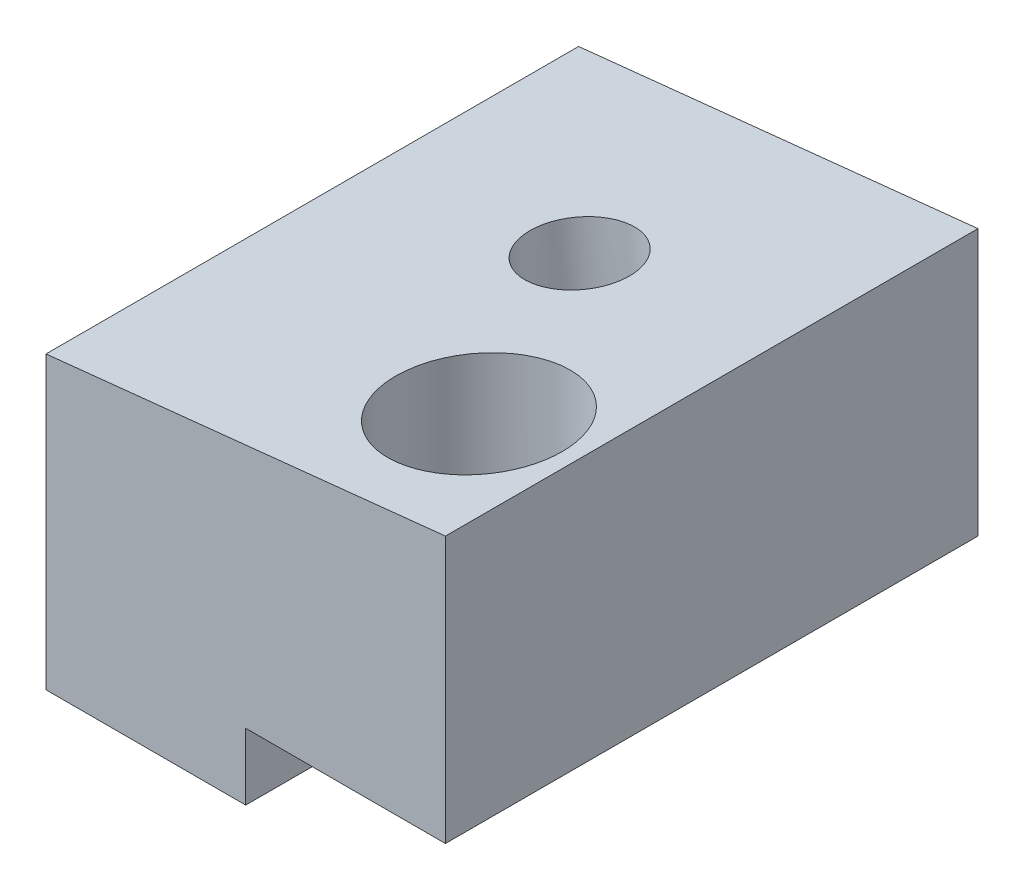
SolidWorks part; units mm, degrees
ref_plane "Front Plane" through (0, 0, 0) normal (0, 0, 1) x (1, 0, 0)
ref_plane "Top Plane" through (0, 0, 0) normal (0, 1, 0) x (1, 0, 0)
ref_plane "Right Plane" through (0, 0, 0) normal (1, 0, 0) x (0, 0, -1)
sketch "Sketch1" plane through (0, 0, 0) normal (0, 0, 1) x (1, 0, 0)
  line L0 (0, 0) -> (9.525, 0)
  line L1 (9.525, 0) -> (9.525, 12.7)
  line L2 (9.525, 12.7) -> (-9.525, 10.6978)
  line L3 (-9.525, 10.6978) -> (-9.525, -3.175)
  line L4 (-9.525, -3.175) -> (0, -3.175)
  line L5 (0, -3.175) -> (0, 0)
  dimension "D1" = 9.525
  dimension "D2" = 9.525
  dimension "D3" = 12.7
  dimension "D4" = 6
  dimension "D5" = 3.175
  dimension "D6" = 19.05
  dimension "D7" = 15.875
extrude "Boss-Extrude1" add sketch "Sketch1" along normal blind 25.4
sketch "Sketch3" plane through (-1.2162, 11.5711, 0) normal (-0.1045, 0.9945, 0) x (0.9945, 0.1045, 0)
  line L0 (10.8003, -25.4) -> (10.8003, 0) construction
  circle A0 centre (1.2753, -9.525) radius 2.3876
  dimension "D1" = 4.7752
  dimension "D2" = 9.525
  dimension "D3" = 9.525
extrude "Cut-Extrude1" cut sketch "Sketch3" against normal blind 15.24
sketch "Sketch4" plane through (0, 0, 0) normal (0, 1, 0) x (1, 0, 0)
  line L0 (9.525, -25.4) -> (9.525, 0) construction
  circle A0 centre (4.7752, -19.05) radius 2.3876
  circle A1 centre (4.7752, -19.05) radius 3.9624
  dimension "D3" = 4.7752
  dimension "D4" = 7.9248
  dimension "D1" = 4.7498
  dimension "D2" = 19.05
sketch "Sketch5" plane through (0, 0, 0) normal (0, 1, 0) x (1, 0, 0)
  circle A0 centre (4.7752, -19.05) radius 2.3876 construction
  circle A1 centre (4.7752, -19.05) radius 2.3876
extrude "Cut-Extrude2" cut sketch "Sketch5" along normal blind 20.32
sketch "Sketch6" plane through (0, 0, 0) normal (0, 1, 0) x (1, 0, 0)
  circle A0 centre (4.7752, -19.05) radius 3.9624 construction
  circle A1 centre (4.7752, -19.05) radius 3.9624
extrude "Cut-Extrude3" cut sketch "Sketch6" along normal blind 20.32 from offset 6.35
